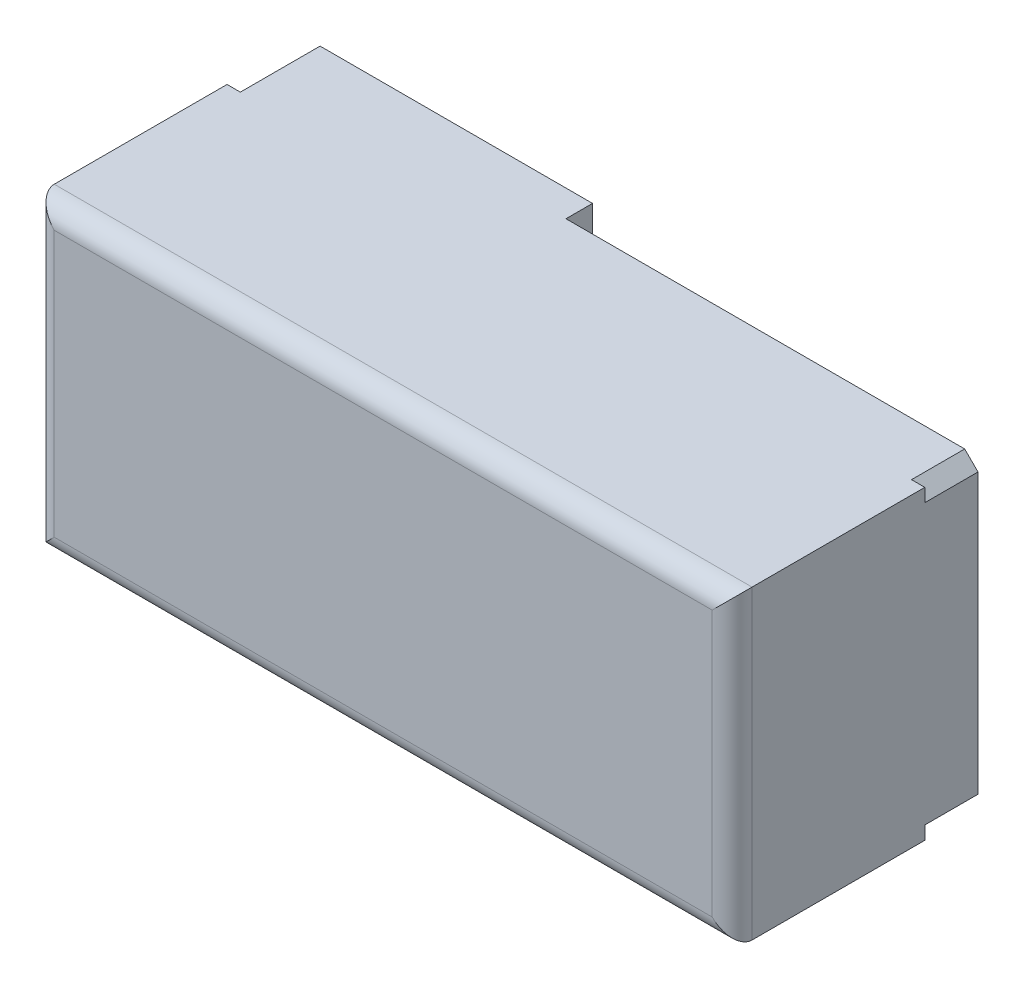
SolidWorks part; units mm, degrees
ref_plane "前视基准面" through (0, 0, 0) normal (0, 0, 1) x (1, 0, 0)
ref_plane "上视基准面" through (0, 0, 0) normal (0, 1, 0) x (1, 0, 0)
ref_plane "右视基准面" through (0, 0, 0) normal (1, 0, 0) x (0, 0, -1)
sketch "草图1" plane through (0, 0, 0) normal (0, 0, 1) x (1, 0, 0)
  line L1 (0, 0) -> (50000, 0) construction
  line L2 (0, 0) -> (0, 50000) construction
  line L3 (-52.5, -23) -> (52.5, -23)
  line L4 (-52.5, -23) -> (-52.5, 23)
  line L5 (-52.5, 23) -> (52.5, 23)
  line L6 (52.5, -23) -> (52.5, 23)
  line L7 (-52.5, -23) -> (52.5, 23) construction
  line L8 (-52.5, 23) -> (52.5, -23) construction
  point P0 (0, 0)
  dimension "D1" = 105
  dimension "D2" = 46
extrude "凸台-拉伸1" add sketch "草图1" along normal blind 12
sketch "草图2" plane through (0, 0, 12) normal (0, 0, 1) x (1, 0, 0)
  line L0 (0, 0) -> (50000, 0) construction
  line L1 (-31.5, -4.609) -> (-31.5, 49995.391) construction
  line L2 (27, -7.691) -> (27, -5.5896) construction
  line L3 (-52.5, 23) -> (-52.5, -23) construction
  line L4 (22, 0) -> (32, 0) construction
  line L5 (22, 5) -> (32, 5)
  line L6 (22, -5) -> (32, -5)
  circle A0 centre (-31.5, 0) radius 8
  arc A1 (22, 5) -> (22, -5) centre (22, 0) ccw
  arc A2 (32, -5) -> (32, 5) centre (32, 0) ccw
  point P13 (27, 0)
  dimension "D3" = 16
  dimension "D4" = 5
  dimension "D1" = 21
  dimension "D2" = 58.5
  dimension "D5" = 10
extrude "切除-拉伸1" cut sketch "草图2" against normal blind 20
sketch "草图3" plane through (0, 0, 12) normal (0, 0, 1) x (1, 0, 0)
  line L0 (41.5, -2.9794) -> (41.5, 49997.0206) construction
  line L1 (26.1169, 11.5) -> (50026.1169, 11.5) construction
  line L2 (34.6113, -11.5) -> (50034.6113, -11.5) construction
  line L3 (-0.5, -19.3341) -> (-0.5, 49980.6659) construction
  line L4 (52.5, -23) -> (52.5, 23) construction
  line L5 (52.5, 23) -> (-52.5, 23) construction
  line L7 (39.5, 11.5) -> (43.5, 11.5) construction
  line L8 (39.5, 13.75) -> (43.5, 13.75)
  line L9 (39.5, 9.25) -> (43.5, 9.25)
  line L10 (-2.5, 11.5) -> (1.5, 11.5) construction
  line L11 (-2.5, 13.75) -> (1.5, 13.75)
  line L12 (-2.5, 9.25) -> (1.5, 9.25)
  line L13 (-2.5, -11.5) -> (1.5, -11.5) construction
  line L14 (-2.5, -9.25) -> (1.5, -9.25)
  line L15 (-2.5, -13.75) -> (1.5, -13.75)
  line L16 (39.5, -11.5) -> (43.5, -11.5) construction
  line L17 (39.5, -9.25) -> (43.5, -9.25)
  line L18 (39.5, -13.75) -> (43.5, -13.75)
  arc A0 (39.5, 13.75) -> (39.5, 9.25) centre (39.5, 11.5) ccw
  arc A1 (43.5, 9.25) -> (43.5, 13.75) centre (43.5, 11.5) ccw
  arc A2 (-2.5, 13.75) -> (-2.5, 9.25) centre (-2.5, 11.5) ccw
  arc A3 (1.5, 9.25) -> (1.5, 13.75) centre (1.5, 11.5) ccw
  arc A4 (-2.5, -9.25) -> (-2.5, -13.75) centre (-2.5, -11.5) ccw
  arc A5 (1.5, -13.75) -> (1.5, -9.25) centre (1.5, -11.5) ccw
  arc A6 (39.5, -9.25) -> (39.5, -13.75) centre (39.5, -11.5) ccw
  arc A7 (43.5, -13.75) -> (43.5, -9.25) centre (43.5, -11.5) ccw
  point P14 (41.5, 11.5)
  point P21 (-0.5, 11.5)
  point P28 (-0.5, -11.5)
  point P35 (41.5, -11.5)
  dimension "D5" = 4.5
  dimension "D1" = 11
  dimension "D2" = 11.5
  dimension "D3" = 42
  dimension "D4" = 23
  dimension "D6" = 4
  dimension "D7" = 4.5
  dimension "D8" = 4
  dimension "D9" = 4.5
  dimension "D10" = 4
  dimension "D11" = 4.5
  dimension "D12" = 4
sketch "草图7" plane through (0, 0, 12) normal (0, 0, 1) x (1, 0, 0)
  line L1 (52.5, -23) -> (52.5, 23) construction
  line L2 (55.75, 0) -> (-49944.25, 0) construction
  line L4 (43.5, -2.9808) -> (43.5, 49997.0192) construction
  line L5 (-14.5, -3.521) -> (-14.5, 49996.479) construction
  point P0 (-14.5, 0)
  point P1 (43.5, 0)
  point P4 (52.5, 0)
  dimension "D1" = 9
  dimension "D2" = 58
hole_wizard "M4 螺纹孔1" positions "3D草图2" profile "草图8" tap size "M4" standard "GB"
sketch3d "3D草图2"
  point P0 (-14.5, 0, 12)
  point P3 (43.5, 0, 12)
sketch "草图8" plane through (-14.5, 0, 12) normal (1, 0, 0) x (0, -1, 0)
  line L0 (0, 0) -> (0, 12)
  line L1 (0, 12) -> (1.65, 12)
  line L2 (1.65, 12) -> (1.65, 0)
  line L5 (1.65, 0) -> (0, 0)
  line L11 (0, -6.35) -> (0, 107.95) construction
  dimension "通孔螺纹孔钻头直径" = 3.3
  dimension "通孔螺纹孔钻头深度" = 12
chamfer "倒角2" distance 2 angle 45 4 edges at (-52.5, -23, 6) (52.5, -23, 6) (-52.5, 23, 6) (52.5, 23, 6)
sketch "草图9" plane through (0, 0, 0) normal (0, 0, -1) x (-1, 0, 0)
  line L0 (-52.5, -21) -> (-52.5, 21) construction
  line L1 (-75.4225, 37.1627) -> (9.5, 37.1627)
  line L2 (-75.4225, 37.1627) -> (-75.4225, -32.4778)
  line L3 (-75.4225, -32.4778) -> (9.5, -32.4778)
  line L4 (9.5, 37.1627) -> (9.5, -32.4778)
  dimension "D1" = 62
extrude "切除-拉伸4" cut sketch "草图9" against normal blind 4
sketch "草图10" plane through (0, 0, 12) normal (0, 0, 1) x (1, 0, 0)
  line L0 (52.5, 23) -> (-52.5, 23)
  line L1 (-52.5, 21) -> (-52.5, -21) construction
  line L2 (-52.5, -23) -> (-52.5, 23)
  line L3 (52.5, -21) -> (52.5, 21) construction
  line L4 (52.5, 23) -> (52.5, -23)
  line L6 (52.5, -23) -> (-52.5, -23)
extrude "凸台-拉伸2" add sketch "草图10" along normal blind 29
fillet "圆角1" radius 3 4 edges at (-52.5, 0, 41) (0, 23, 41) (52.5, 0, 41) (0, -23, 41)
